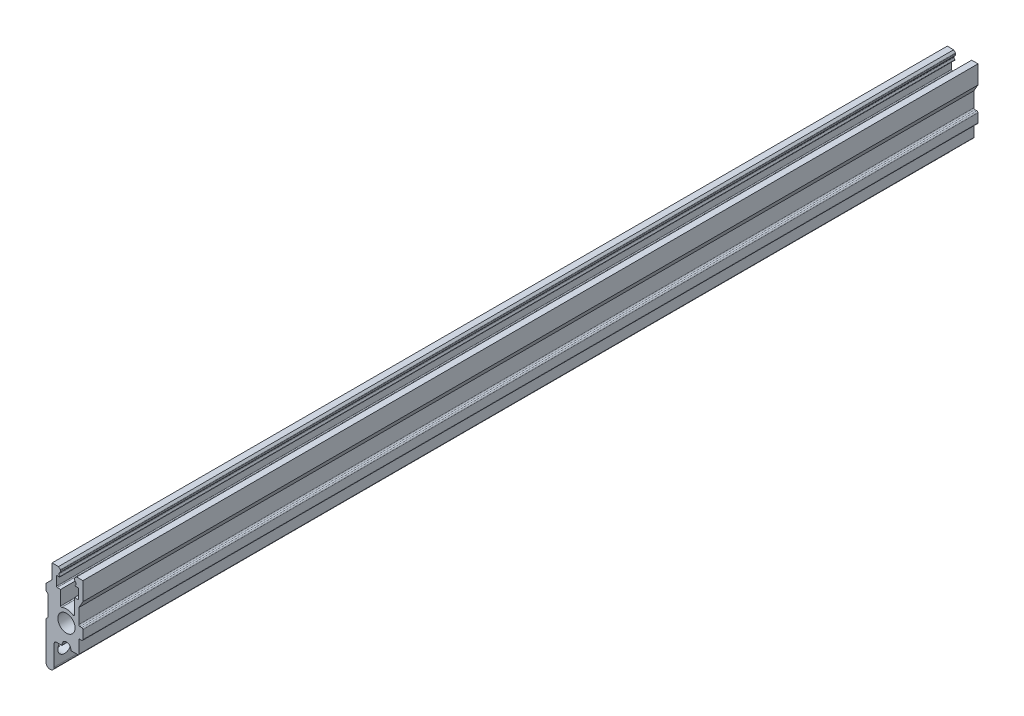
SolidWorks part; units mm, degrees
ref_plane "前视基准面" through (0, 0, 0) normal (0, 0, 1) x (1, 0, 0)
ref_plane "上视基准面" through (0, 0, 0) normal (0, 1, 0) x (1, 0, 0)
ref_plane "右视基准面" through (0, 0, 0) normal (1, 0, 0) x (0, 0, -1)
sketch "草图1" plane through (0, 0, 0) normal (0, 0, 1) x (1, 0, 0)
  line L0 (-2.3509, 8.9116) -> (-2.3509, 6.6116)
  line L1 (-2.3509, 8.9116) -> (-1.4509, 8.9116)
  line L2 (-1.4509, 8.9116) -> (-1.4509, 11.7916)
  line L3 (-1.4509, 11.7916) -> (-4.1259, 11.7916)
  line L4 (-4.1259, 11.7916) -> (-4.1259, 10.0616)
  line L5 (-4.1259, 10.0616) -> (-3.5009, 9.8916)
  line L6 (-3.5009, 9.8916) -> (-3.5009, 8.5216)
  line L7 (-3.5009, 8.5216) -> (-5.0009, 8.5216)
  line L8 (-5.0009, 8.5216) -> (-5.0009, 4.4416)
  line L9 (-5.0009, 4.4416) -> (-4.5507, 3.9414)
  line L10 (-4.5507, 3.9414) -> (-4.551, -1.0586)
  line L11 (-4.551, -1.0586) -> (-5.0009, -1.5584)
  line L12 (-5.0009, -1.5584) -> (-5.0009, -10.75)
  line L13 (-3.0009, -10.75) -> (-3.0009, -5.75)
  line L14 (2.9991, -5.05) -> (2.9991, -2.0584)
  line L15 (3.2991, -1.7584) -> (3.6991, -1.7584)
  line L16 (3.9991, -2.0584) -> (3.9991, -3.4584) construction
  line L17 (4.2991, -3.7584) -> (4.6991, -3.7584) construction
  line L18 (4.9991, -3.4584) -> (4.9991, 2.6416) construction
  line L19 (4.6991, 2.9416) -> (4.2991, 2.9416) construction
  line L20 (3.9991, 2.6416) -> (3.9991, 1.2416) construction
  line L21 (3.6991, 0.9416) -> (3.2991, 0.9416)
  line L22 (2.9991, 1.2416) -> (2.9991, 4.8054)
  line L23 (2.9991, 4.8054) -> (3.9991, 6.5374)
  line L24 (3.9991, 6.5374) -> (3.9991, 9.5216)
  line L25 (3.9991, 9.5216) -> (3.1241, 9.5216)
  line L26 (3.1241, 10.7916) -> (3.1241, 11.7916)
  line L27 (3.1241, 11.7916) -> (1.9491, 11.7916)
  line L28 (1.9491, 11.7916) -> (1.9491, 8.9116)
  line L29 (1.9491, 8.9116) -> (2.8491, 8.9116)
  line L30 (2.8491, 6.6116) -> (2.8491, 8.9116)
  line L31 (2.8491, 6.6116) -> (1.9491, 6.6116)
  line L32 (1.9491, 6.6116) -> (1.9491, 2.6797)
  line L33 (-1.4509, 2.9454) -> (-1.4509, 6.6116)
  line L34 (-1.4509, 6.6116) -> (-2.3509, 6.6116)
  line L35 (0, 0) -> (0, -5) construction
  line L36 (-1.05, -5) -> (-1.05, -5.15)
  line L37 (1.05, -5) -> (1.05, -5.15)
  line L38 (1.15, -5.25) -> (2.7991, -5.25)
  line L39 (-2.5009, -5.25) -> (-1.15, -5.25)
  line L40 (-1.4509, 10.3516) -> (1.9491, 10.3516) construction
  line L41 (-3.0009, -10.75) -> (-5.0009, -10.75) construction
  line L42 (0.2491, 10.3516) -> (0.2491, 6.8507) construction
  line L44 (3.9991, 0.6416) -> (3.9991, -1.4584)
  arc A0 (-5.0009, -10.75) -> (-3.0009, -10.75) centre (-4.0009, -10.75) ccw
  arc A1 (3.2991, -1.7584) -> (2.9991, -2.0584) centre (3.2991, -2.0584) ccw
  arc A2 (3.9991, -2.0584) -> (3.6991, -1.7584) centre (3.6991, -2.0584) ccw construction
  arc A3 (3.9991, -3.4584) -> (4.2991, -3.7584) centre (4.2991, -3.4584) ccw construction
  arc A4 (4.6991, -3.7584) -> (4.9991, -3.4584) centre (4.6991, -3.4584) ccw construction
  arc A5 (4.9991, 2.6416) -> (4.6991, 2.9416) centre (4.6991, 2.6416) ccw construction
  arc A6 (4.2991, 2.9416) -> (3.9991, 2.6416) centre (4.2991, 2.6416) ccw construction
  arc A7 (3.6991, 0.9416) -> (3.9991, 1.2416) centre (3.6991, 1.2416) ccw construction
  arc A8 (2.9991, 1.2416) -> (3.2991, 0.9416) centre (3.2991, 1.2416) ccw
  arc A9 (3.1241, 10.7916) -> (3.1241, 9.5216) centre (3.1841, 10.1566) ccw
  circle A10 centre (0, 0) radius 1.6
  arc A11 (1.6398, 2.5122) -> (-1.1727, 2.7613) centre (0, 0) ccw
  arc A12 (1.6398, 2.5122) -> (1.9491, 2.6797) centre (1.7491, 2.6797) ccw
  arc A13 (-1.4509, 2.9454) -> (-1.1727, 2.7613) centre (-1.2509, 2.9454) ccw
  arc A14 (1.05, -5) -> (-1.05, -5) centre (0, -5) ccw
  arc A15 (1.15, -5.25) -> (1.05, -5.15) centre (1.15, -5.15) cw
  arc A16 (-1.05, -5.15) -> (-1.15, -5.25) centre (-1.15, -5.15) cw
  arc A17 (3.6991, 0.9416) -> (3.9991, 0.6416) centre (3.6991, 0.6416) cw
  arc A18 (3.9991, -1.4584) -> (3.6991, -1.7584) centre (3.6991, -1.4584) cw
  arc A19 (2.7991, -5.25) -> (2.9991, -5.05) centre (2.7991, -5.05) ccw
  arc A20 (-3.0009, -5.75) -> (-2.5009, -5.25) centre (-2.5009, -5.75) cw
  point P72 (1.05, -5.25)
  dimension "D1" = 2.1
  dimension "D3" = 5
  dimension "D4" = 0.1
  dimension "D6" = 0.3
  dimension "D2" = 10.75
  dimension "D5" = 5.2
extrude "凸台-拉伸1" add sketch "草图1" along normal mid plane 218.44
sketch "草图9" plane through (0, 0, -109.22) normal (0, 0, -1) x (-1, 0, 0)
  line L0 (2.3509, 8.9116) -> (1.4509, 8.9116) construction
  line L1 (2.4509, 8.9116) -> (-2.9491, 8.9116)
  line L2 (2.4509, 8.9116) -> (2.4509, 6.4116)
  line L3 (2.4509, 6.4116) -> (-2.9491, 6.4116)
  line L4 (-2.9491, 8.9116) -> (-2.9491, 6.4116)
  line L5 (2.3509, 6.6116) -> (2.3509, 8.9116) construction
  line L6 (-2.8491, 8.9116) -> (-2.8491, 6.6116) construction
  line L7 (-2.8491, 6.6116) -> (-1.9491, 6.6116) construction
  dimension "D1" = 0.1
  dimension "D2" = 0.1
  dimension "D3" = 0.2
extrude "切除-拉伸7" cut sketch "草图9" against normal through all
fillet "圆角4" radius 0.2 4 edges at (-2.4509, 8.9116, 0) (-2.4509, 6.4116, 0) (2.9491, 8.9116, 0) (2.9491, 6.4116, 0)
sketch "草图2" plane through (0, 0, -109.22) normal (0, 0, -1) x (-1, 0, 0)
  circle A0 centre (0, 0) radius 2.1
  dimension "D1" = 4.2
extrude "切除-拉伸1" cut sketch "草图2" against normal blind 10
sketch "草图3" plane through (0, 0, 109.22) normal (0, 0, 1) x (1, 0, 0)
  circle A0 centre (0, 0) radius 2.1
  dimension "D1" = 4.2
extrude "切除-拉伸2" cut sketch "草图3" against normal blind 10
sketch "草图4" plane through (-5.0009, 0, 0) normal (-1, 0, 0) x (0, 0, 1)
  line L0 (-109.22, -1.5584) -> (-109.22, -10.75) construction
  line L1 (-109.22, -11.75) -> (109.22, -11.75) construction
  circle A0 centre (-106.68, -7.5) radius 1.65
  circle A1 centre (-101.6, -7.5) radius 1.65
  circle A2 centre (-96.52, -7.5) radius 1.65
  circle A3 centre (-91.44, -7.5) radius 1.65
  circle A4 centre (-86.36, -7.5) radius 1.65
  circle A5 centre (-81.28, -7.5) radius 1.65
  circle A6 centre (-76.2, -7.5) radius 1.65
  circle A7 centre (-71.12, -7.5) radius 1.65
  circle A8 centre (-66.04, -7.5) radius 1.65
  circle A9 centre (-60.96, -7.5) radius 1.65
  circle A10 centre (-55.88, -7.5) radius 1.65
  circle A11 centre (-50.8, -7.5) radius 1.65
  circle A12 centre (-45.72, -7.5) radius 1.65
  circle A13 centre (-40.64, -7.5) radius 1.65
  circle A14 centre (-35.56, -7.5) radius 1.65
  circle A15 centre (-30.48, -7.5) radius 1.65
  circle A16 centre (-25.4, -7.5) radius 1.65
  circle A17 centre (-20.32, -7.5) radius 1.65
  circle A18 centre (-15.24, -7.5) radius 1.65
  circle A19 centre (-10.16, -7.5) radius 1.65
  circle A20 centre (-5.08, -7.5) radius 1.65
  circle A21 centre (0, -7.5) radius 1.65
  circle A22 centre (5.08, -7.5) radius 1.65
  circle A23 centre (10.16, -7.5) radius 1.65
  circle A24 centre (15.24, -7.5) radius 1.65
  circle A25 centre (20.32, -7.5) radius 1.65
  circle A26 centre (25.4, -7.5) radius 1.65
  circle A27 centre (30.48, -7.5) radius 1.65
  circle A28 centre (35.56, -7.5) radius 1.65
  circle A29 centre (40.64, -7.5) radius 1.65
  circle A30 centre (45.72, -7.5) radius 1.65
  circle A31 centre (50.8, -7.5) radius 1.65
  circle A32 centre (55.88, -7.5) radius 1.65
  circle A33 centre (60.96, -7.5) radius 1.65
  circle A34 centre (66.04, -7.5) radius 1.65
  circle A35 centre (71.12, -7.5) radius 1.65
  circle A36 centre (76.2, -7.5) radius 1.65
  circle A37 centre (81.28, -7.5) radius 1.65
  circle A38 centre (86.36, -7.5) radius 1.65
  circle A39 centre (91.44, -7.5) radius 1.65
  circle A40 centre (96.52, -7.5) radius 1.65
  circle A41 centre (101.6, -7.5) radius 1.65
  circle A42 centre (106.68, -7.5) radius 1.65
  circle A43 centre (111.76, -7.5) radius 1.65
  circle A44 centre (116.84, -7.5) radius 1.65
  circle A45 centre (121.92, -7.5) radius 1.65
  circle A46 centre (127, -7.5) radius 1.65
  circle A47 centre (132.08, -7.5) radius 1.65
  circle A48 centre (137.16, -7.5) radius 1.65
  circle A49 centre (142.24, -7.5) radius 1.65
  circle A50 centre (147.32, -7.5) radius 1.65
  circle A51 centre (152.4, -7.5) radius 1.65
  circle A52 centre (157.48, -7.5) radius 1.65
  circle A53 centre (162.56, -7.5) radius 1.65
  circle A54 centre (167.64, -7.5) radius 1.65
  circle A55 centre (172.72, -7.5) radius 1.65
  circle A56 centre (177.8, -7.5) radius 1.65
  circle A57 centre (182.88, -7.5) radius 1.65
  circle A58 centre (187.96, -7.5) radius 1.65
  circle A59 centre (193.04, -7.5) radius 1.65
  circle A60 centre (198.12, -7.5) radius 1.65
  circle A61 centre (203.2, -7.5) radius 1.65
  circle A62 centre (208.28, -7.5) radius 1.65
  circle A63 centre (213.36, -7.5) radius 1.65
  circle A64 centre (218.44, -7.5) radius 1.65
  circle A65 centre (223.52, -7.5) radius 1.65
  circle A66 centre (228.6, -7.5) radius 1.65
  circle A67 centre (233.68, -7.5) radius 1.65
  circle A68 centre (238.76, -7.5) radius 1.65
  circle A69 centre (243.84, -7.5) radius 1.65
  circle A70 centre (248.92, -7.5) radius 1.65
  circle A71 centre (254, -7.5) radius 1.65
  circle A72 centre (259.08, -7.5) radius 1.65
  circle A73 centre (264.16, -7.5) radius 1.65
  circle A74 centre (269.24, -7.5) radius 1.65
  circle A75 centre (274.32, -7.5) radius 1.65
  circle A76 centre (279.4, -7.5) radius 1.65
  circle A77 centre (284.48, -7.5) radius 1.65
  circle A78 centre (289.56, -7.5) radius 1.65
  circle A79 centre (294.64, -7.5) radius 1.65
  circle A80 centre (299.72, -7.5) radius 1.65
  circle A81 centre (304.8, -7.5) radius 1.65
  circle A82 centre (309.88, -7.5) radius 1.65
  circle A83 centre (314.96, -7.5) radius 1.65
  circle A84 centre (320.04, -7.5) radius 1.65
  dimension "D1" = 3.3
  dimension "D5" = 5.08
  dimension "D2" = 2.54
  dimension "D3" = 4.25
  dimension "D4" = 85
extrude "切除-拉伸3" cut sketch "草图4" against normal blind 12
sketch "草图5" plane through (0, 0, 109.22) normal (0, 0, 1) x (1, 0, 0)
  line L0 (1.9491, 8.9116) -> (2.7491, 8.9116) construction
  line L1 (1.9491, 8.9116) -> (3.9991, 8.9116)
  line L2 (1.9491, 8.9116) -> (1.9491, 11.7916)
  line L3 (1.9491, 11.7916) -> (3.9991, 11.7916)
  line L4 (3.9991, 8.9116) -> (3.9991, 11.7916)
  line L5 (3.1241, 11.7916) -> (1.9491, 11.7916) construction
  line L6 (3.9991, 6.5374) -> (3.9991, 9.5216) construction
  line L7 (-1.4509, 11.7916) -> (-4.1259, 11.7916) construction
  line L8 (-5.0009, 8.5216) -> (-2.7884, 8.5216)
  line L9 (-5.0009, 8.5216) -> (-5.0009, 11.7916)
  line L10 (-5.0009, 11.7916) -> (-2.7884, 11.7916)
  line L11 (-2.7884, 8.5216) -> (-2.7884, 11.7916)
extrude "凸台-拉伸2" add sketch "草图5" against normal up to surface (218.44 mm away)
sketch "草图6" plane through (0, 0, -109.22) normal (0, 0, -1) x (-1, 0, 0)
  line L0 (-1.9491, 9.4916) -> (1.4509, 9.4916) construction
  line L1 (-1.9491, 11.7916) -> (-1.9491, 8.9116) construction
  line L2 (1.4509, 8.9116) -> (1.4509, 11.7916) construction
  line L3 (1.4509, 11.7916) -> (5.0009, 11.7916) construction
  line L4 (-2.3491, 8.9916) -> (1.8509, 8.9916)
  line L5 (-2.3491, 8.9916) -> (-2.3491, 9.9916)
  line L6 (-2.3491, 9.9916) -> (1.8509, 9.9916)
  line L7 (1.8509, 8.9916) -> (1.8509, 9.9916)
  line L8 (-2.3491, 8.9916) -> (1.8509, 9.9916) construction
  line L9 (-2.3491, 9.9916) -> (1.8509, 8.9916) construction
  point P6 (-0.2491, 9.4916)
  dimension "D1" = 1
  dimension "D2" = 4.2
  dimension "D3" = 1.8
extrude "切除-拉伸4" cut sketch "草图6" against normal through all
sketch "草图8" plane through (0, 0, -109.22) normal (0, 0, -1) x (-1, 0, 0)
  line L0 (5.0009, 11.7916) -> (5.0009, 4.4416) construction
  line L1 (-3.9991, 11.7916) -> (5.0009, 11.7916)
  line L2 (-3.9991, 11.7916) -> (-3.9991, 11.0016)
  line L3 (-3.9991, 11.0016) -> (5.0009, 11.0016)
  line L4 (5.0009, 11.7916) -> (5.0009, 11.0016)
  dimension "D1" = 0.79
extrude "切除-拉伸6" cut sketch "草图8" against normal through all
fillet "圆角1" radius 0.5 4 edges at (-1.8509, 9.9916, 0) (-1.8509, 8.9916, 0) (2.3491, 9.9916, 0) (2.3491, 8.9916, 0)
chamfer "倒角1" distance 0.5 angle 45 2 edges at (-1.4509, 11.0016, 0) (1.9491, 11.0016, 0)
fillet "圆角2" radius 0.2 6 edges at (1.9491, 10.5016, 0) (-1.4509, 10.5016, 0) (-1.4509, 8.9916, 0) (-1.4509, 9.9916, 0) (1.9491, 8.9916, 0) (1.9491, 9.9916, 0)
fillet "圆角3" radius 0.1 2 edges at (-1.4509, 8.9116, 0) (1.9491, 8.9116, 0)
sketch "草图7" plane through (0, 0, -109.22) normal (0, 0, -1) x (-1, 0, 0)
  line L0 (5.0009, 11.0016) -> (3.5009, 11.0016)
  line L2 (3.5009, 11.0016) -> (3.5009, 7.4416)
  line L3 (3.5009, 7.4416) -> (5.0009, 5.9416)
  line L4 (5.0009, 11.0016) -> (5.0009, 4.4416) construction
  line L5 (5.0009, 5.9416) -> (5.0009, 11.0016)
  line L6 (1.4509, 10.1341) -> (1.4509, 10.4187) construction
  line L7 (1.9509, 11.0016) -> (5.0009, 11.0016) construction
  dimension "D1" = 2.05
  dimension "D2" = 1.5
  dimension "D3" = 45
extrude "切除-拉伸5" cut sketch "草图7" against normal through all
